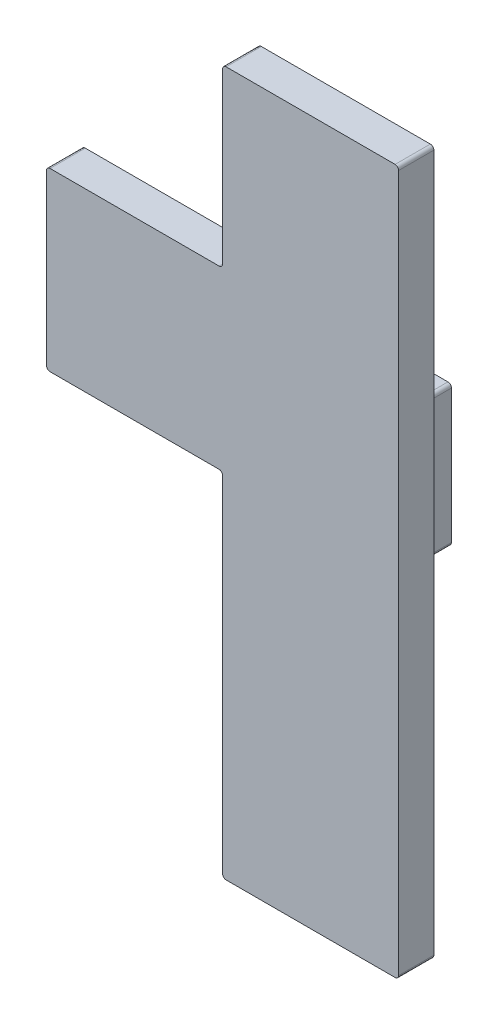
SolidWorks part; units mm, degrees
ref_plane "Ebene vorne" through (0, 0, 0) normal (0, 0, 1) x (1, 0, 0)
ref_plane "Ebene oben" through (0, 0, 0) normal (0, 1, 0) x (1, 0, 0)
ref_plane "Ebene rechts" through (0, 0, 0) normal (1, 0, 0) x (0, 0, -1)
sketch "Skizze1" plane through (0, 0, 0) normal (0, 0, 1) x (1, 0, 0)
  line L0 (0, 0) -> (0, 50)
  line L1 (0, 50) -> (-25, 50)
  line L2 (-25, 50) -> (-25, 75)
  line L3 (-25, 75) -> (0, 75)
  line L4 (0, 75) -> (0, 100)
  line L5 (0, 100) -> (25, 100)
  line L6 (25, 100) -> (25, 0)
  line L7 (25, 0) -> (0, 0)
  dimension "D1" = 25
  dimension "D2" = 100
extrude "Aufsatz-Linear austragen1" add sketch "Skizze1" along normal blind 5
sketch "Skizze2" plane through (0, 0, 5) normal (0, 0, 1) x (1, 0, 0)
  line L0 (25, 100) -> (0, 100) construction
  line L1 (0, 100) -> (0, 75) construction
  circle A0 centre (12.5, 87.5) radius 2.7
  point P4 (12.5, 100)
  point P8 (0, 87.5)
  dimension "D1" = 5.4
extrude "Schnitt-Linear austragen1" cut sketch "Skizze2" against normal blind 2.9 from offset 0.8
fillet "Verrundung1" radius 0.5 8 edges at (25, 0, 2.5) (0, 0, 2.5) (0, 50, 2.5) (-25, 50, 2.5) (0, 75, 2.5) (-25, 75, 2.5) (0, 100, 2.5) (25, 100, 2.5)
sketch "Skizze3" plane through (0, 0, 0) normal (0, 0, -1) x (-1, 0, 0)
  line L0 (-25, 0.5) -> (-25, 99.5) construction
  line L1 (-15.5, 60) -> (-9.5, 60)
  line L2 (-15.5, 60) -> (-15.5, 40)
  line L3 (-15.5, 40) -> (-9.5, 40)
  line L4 (-9.5, 60) -> (-9.5, 40)
  line L5 (-24.5, 100) -> (-0.5, 100) construction
  point P6 (-25, 50)
  point P7 (-15.5, 50)
  point P10 (-12.5, 100)
  point P11 (-12.5, 60)
  dimension "D1" = 6
  dimension "D2" = 20
extrude "Aufsatz-Linear austragen2" add sketch "Skizze3" along normal blind 12
fillet "Verrundung2" radius 1.5 4 edges at (12.5, 60, 0) (9.5, 50, 0) (12.5, 40, 0) (15.5, 50, 0)
fillet "Verrundung3" radius 0.5 8 edges at (15.9393, 60.4393, -0.4393) (15.9393, 39.5607, -0.4393) (9.0607, 39.5607, -0.4393) (9.0607, 60.4393, -0.4393) (15.5, 60, -6.75) (15.5, 40, -6.75) (9.5, 40, -6.75) (9.5, 60, -6.75)
